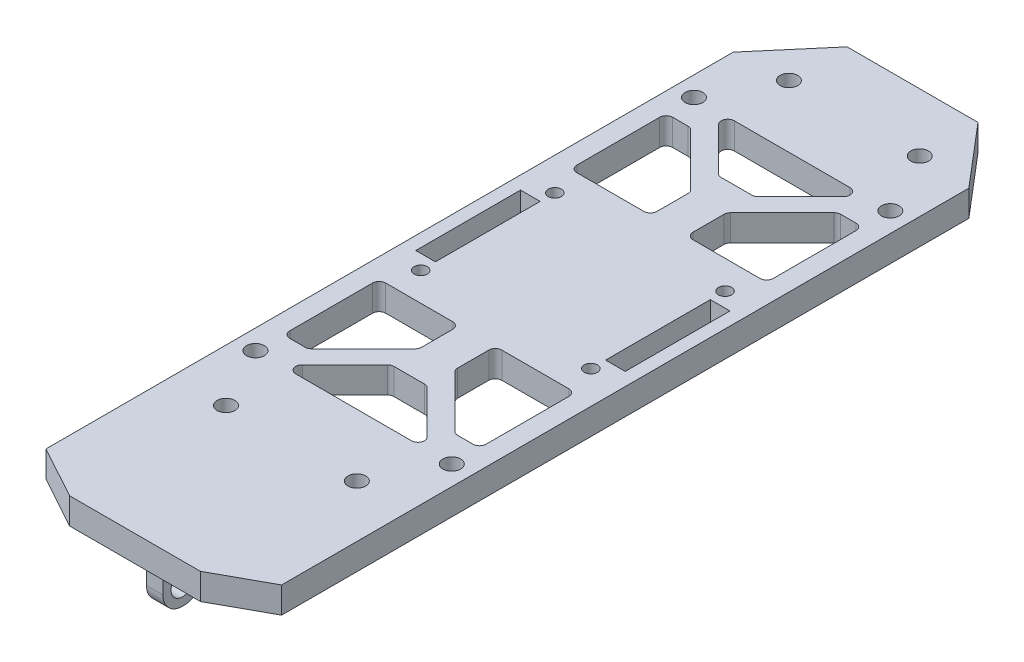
SolidWorks part; units mm, degrees
ref_plane "Front Plane" through (0, 0, 0) normal (0, 0, 1) x (1, 0, 0)
ref_plane "Top Plane" through (0, 0, 0) normal (0, 1, 0) x (1, 0, 0)
ref_plane "Right Plane" through (0, 0, 0) normal (1, 0, 0) x (0, 0, -1)
body saved out of another part "Stock-MTF-02P AIO Mount-1"
sketch "Sketch1" plane through (0, -3.5, 0) normal (0, 1, 0) x (1, 0, 0)
  line L0 (18, 34.5) -> (18, -34.5) construction
  line L1 (-18, -34.5) -> (18, -34.5)
  line L2 (-18, -34.5) -> (-18, -66.9)
  line L3 (-18, -66.9) -> (18, -66.9)
  line L4 (18, -34.5) -> (18, -66.9)
  line L5 (-18, -62.5) -> (-10, -66.9)
  line L6 (-10, -66.9) -> (10, -66.9)
  line L7 (10, -66.9) -> (18, -62.5)
  line L8 (-18, -62.5) -> (18, -62.5)
  dimension "D1" = 32.4
  dimension "D2" = 20
  dimension "D3" = 28
extrude "Boss-Extrude1" add sketch "Sketch1" against normal blind 4 contours L8 L5 L3 L7 | L2 L8 L4 L1
sketch "Sketch2" plane through (0, -7.5, 0) normal (0, -1, 0) x (1, 0, 0)
  line L0 (-10, 66.9) -> (10, 66.9) construction
  line L5 (-1.25, 63.9) -> (1.25, 63.9)
  line L6 (-1.25, 63.9) -> (-1.25, 57.67)
  line L7 (-1.25, 57.67) -> (1.25, 57.67)
  line L8 (1.25, 63.9) -> (1.25, 57.67)
  point P14 (0, 57.67)
  dimension "D1" = 2.5
  dimension "D2" = 6.23
  dimension "D5" = 3
extrude "Boss-Extrude2" add sketch "Sketch2" along normal blind 8
fillet "Fillet1" radius 3 2 edges at (0, -15.5, 63.9) (0, -15.5, 57.67)
hole_wizard "Ø2.7 (2.7) Diameter Hole1" positions "Sketch5" profile "Sketch6" hole size "Ø2.7" standard "ANSI Metric"
sketch "Sketch5" plane through (0, -7.5, 0) normal (0, -1, 0) x (-1, 0, 0)
  arc A0 (-14.0931, -34.5) -> (-15.9069, -34.5) centre (-15, -33.5) ccw construction
  arc A1 (15.9069, -34.5) -> (14.0931, -34.5) centre (15, -33.5) ccw construction
  point P0 (-15, -33.5)
  point P2 (15, -33.5)
sketch "Sketch6" plane through (15, -7.5, 33.5) normal (1, 0, 0) x (0, 0, -1)
  line L0 (0, 0) -> (0, 7.5)
  line L1 (0, 7.5) -> (1.35, 7.5)
  line L2 (1.35, 7.5) -> (1.35, 0.025)
  line L3 (1.35, 0.025) -> (1.375, 0)
  line L5 (1.375, 0) -> (0, 0)
  line L6 (-1.35, 0.025) -> (-1.375, 0) construction
  line L11 (0, -6.35) -> (0, 107.95) construction
  dimension "Thru Hole Dia." = 2.7
  dimension "Thru Hole Depth" = 7.5
  dimension "Near C'Sink Dia." = 2.75
  dimension "Near C'Sink Angle" = 90
hole_wizard "Ø2.0 (2) Diameter Hole1" positions "Sketch10" profile "Sketch11" hole size "Ø2.0" standard "ANSI Metric"
sketch "Sketch10" plane through (0, 0, 0) normal (0, 1, 0) x (1, 0, 0)
  point P0 (-13, -10.25)
  point P3 (-13, 10.25)
  point P6 (13, 10.25)
  point P9 (13, -10.25)
sketch "Sketch11" plane through (-13, 0, 10.25) normal (1, 0, 0) x (0, 0, 1)
  line L0 (0, 0) -> (0, 6.6009)
  line L1 (0, 6.6009) -> (1, 6)
  line L2 (1, 6) -> (1, 0.025)
  line L3 (1, 0.025) -> (1.025, 0)
  line L5 (1.025, 0) -> (0, 0)
  line L6 (-1, 0.025) -> (-1.025, 0) construction
  line L10 (0, 6.6009) -> (-1, 6) construction
  line L11 (0, -6.35) -> (0, 107.95) construction
  dimension "Hole Dia." = 2
  dimension "Hole Depth" = 6
  dimension "Near C'Sink Dia." = 2.05
  dimension "Near C'Sink Angle" = 90
  dimension "Drill Angle" = 118
sketch "Sketch9" plane through (0, -3.5, 0) normal (0, 1, 0) x (1, 0, 0)
  line L1 (-41.1394, 18.8507) -> (39.5229, 18.8507)
  line L2 (-41.1394, 18.8507) -> (-41.1394, -15.6612)
  line L3 (-41.1394, -15.6612) -> (39.5229, -15.6612)
  line L4 (39.5229, 18.8507) -> (39.5229, -15.6612)
extrude "Cut-Extrude1" cut sketch "Sketch9" along normal blind 3.5
fillet "Fillet2" radius 1.5 2 edges at (-1.25, -7.5, 60.785) (1.25, -7.5, 60.785)
hole_wizard "Ø3.5 (3.5) Diameter Hole1" positions "Sketch12" profile "Sketch13" hole size "Ø3.5" standard "ANSI Metric"
sketch "Sketch12" plane through (1.25, 0, 0) normal (1, 0, 0) x (0, 0, -1)
  point P0 (-60.9, -12.5)
sketch "Sketch13" plane through (1.25, -12.5, 60.9) normal (0, 1, 0) x (0, 0, -1)
  line L0 (0, 0) -> (0, 19.25)
  line L1 (0, 19.25) -> (1.75, 19.25)
  line L2 (1.75, 19.25) -> (1.75, 0.025)
  line L3 (1.75, 0.025) -> (1.775, 0)
  line L5 (1.775, 0) -> (0, 0)
  line L6 (-1.75, 0.025) -> (-1.775, 0) construction
  line L11 (0, -6.35) -> (0, 107.95) construction
  dimension "Thru Hole Dia." = 3.5
  dimension "Thru Hole Depth" = 19.25
  dimension "Near C'Sink Dia." = 3.55
  dimension "Near C'Sink Angle" = 90
sketch "Sketch14" plane through (0, -3.5, 0) normal (0, 1, 0) x (1, 0, 0)
  line L0 (0, -94.0114) -> (0, 63.9672) construction
  line L1 (-66.0775, 0) -> (54.3579, 0) construction
  line L5 (-18, -62.5) -> (-10, -66.9) construction
  line L6 (-10, -66.9) -> (10, -66.9) construction
  line L7 (10, -66.9) -> (18, -62.5) construction
  line L8 (10, -66.9) -> (18, -62.5)
  line L9 (-10, -66.9) -> (10, -66.9)
  line L10 (-18, -62.5) -> (-10, -66.9)
  line L15 (10, 51.9) -> (18, 42.5)
  line L17 (18, 42.5) -> (18, 34.5)
  line L18 (16, 36.5) -> (-16, 36.5) construction
  line L19 (16, 36.5) -> (-16, 36.5)
  line L20 (-20.9557, 34.5) -> (29.193, 34.5) construction
  line L21 (-18, 42.5) -> (-18, 34.5)
  line L22 (-10, 51.9) -> (-18, 42.5)
  line L23 (-10, 51.9) -> (10, 51.9)
  circle A0 centre (9.9947, -43.0023) radius 1.35
  circle A1 centre (-9.9947, -43.0023) radius 1.35
  circle A2 centre (15, -33.5) radius 1.35 construction
  circle A3 centre (-15, -33.5) radius 1.35 construction
  circle A4 centre (9.9947, 43.0023) radius 1.35
  circle A5 centre (-9.9947, 43.0023) radius 1.35
  arc A6 (-16, 36.5) -> (-18, 34.5) centre (-16, 34.5) ccw construction
  arc A7 (18, 34.5) -> (16, 36.5) centre (16, 34.5) ccw construction
  arc A8 (18, 34.5) -> (16, 36.5) centre (16, 34.5) ccw
  arc A9 (-16, 36.5) -> (-18, 34.5) centre (-16, 34.5) ccw
  dimension "D1" = 10.74
  dimension "D2" = 26.74
  dimension "D3" = 2.7
  dimension "D4" = 26.74
  dimension "D5" = 10.74
  dimension "D6" = 8
  dimension "D7" = 20
  dimension "D8" = 17.4
extrude "Boss-Extrude3" add sketch "Sketch14" against normal up to surface (4 mm away)
sketch "Sketch15" plane through (0, -3.5, 0) normal (0, 1, 0) x (1, 0, 0)
  circle A1 centre (-9.9947, -43.0023) radius 1.35
  circle A2 centre (-9.9947, -43.0023) radius 1.35
  circle A3 centre (9.9947, -43.0023) radius 1.35
  circle A4 centre (9.9947, -43.0023) radius 1.35
  dimension "D1" = 0
  dimension "D2" = 0
extrude "Cut-Extrude2" cut sketch "Sketch15" against normal through all
sketch "Sketch18" plane through (-1.25, 0, 0) normal (-1, 0, 0) x (0, 0, 1)
  line L1 (50.9, -24.9653) -> (50.9, 2.4946) construction
  line L2 (63.9, -9) -> (63.9, -7.5) construction
  line L3 (63.9, -7.5) -> (57.67, -7.5) construction
  line L7 (57.67, -7.5) -> (57.67, -9) construction
  line L12 (63.9, -12.5) -> (63.9, -9) construction
  line L13 (57.67, -9) -> (57.67, -12.5) construction
  line L14 (60.67, -15.5) -> (60.9, -15.5) construction
  line L15 (63.9, -9) -> (63.9, -7.5)
  line L16 (63.9, -7.5) -> (57.67, -7.5)
  line L17 (57.67, -7.5) -> (57.67, -9)
  line L18 (63.9, -12.5) -> (63.9, -9)
  line L19 (57.67, -9) -> (57.67, -12.5)
  line L20 (60.67, -15.5) -> (60.9, -15.5)
  line L21 (37.9, -12.5) -> (37.9, -9)
  line L22 (41.13, -15.5) -> (40.9, -15.5)
  line L23 (44.13, -9) -> (44.13, -12.5)
  line L24 (44.13, -7.5) -> (44.13, -9)
  line L25 (37.9, -7.5) -> (44.13, -7.5)
  line L26 (37.9, -9) -> (37.9, -7.5)
  arc A0 (57.67, -12.5) -> (60.67, -15.5) centre (60.67, -12.5) ccw construction
  arc A1 (60.9, -15.5) -> (63.9, -12.5) centre (60.9, -12.5) ccw construction
  arc A6 (57.67, -12.5) -> (60.67, -15.5) centre (60.67, -12.5) ccw
  arc A7 (60.9, -15.5) -> (63.9, -12.5) centre (60.9, -12.5) ccw
  circle A8 centre (60.9, -12.5) radius 1.75 construction
  circle A9 centre (60.9, -12.5) radius 1.75
  arc A10 (40.9, -15.5) -> (37.9, -12.5) centre (40.9, -12.5) cw
  arc A11 (44.13, -12.5) -> (41.13, -15.5) centre (41.13, -12.5) cw
  circle A12 centre (40.9, -12.5) radius 1.75
  dimension "D1" = 10
extrude "Boss-Extrude4" add sketch "Sketch18" against normal up to surface (2.5 mm away)
fillet "Fillet3" radius 1.5 2 edges at (1.25, -7.5, 41.015) (-1.25, -7.5, 41.015)
